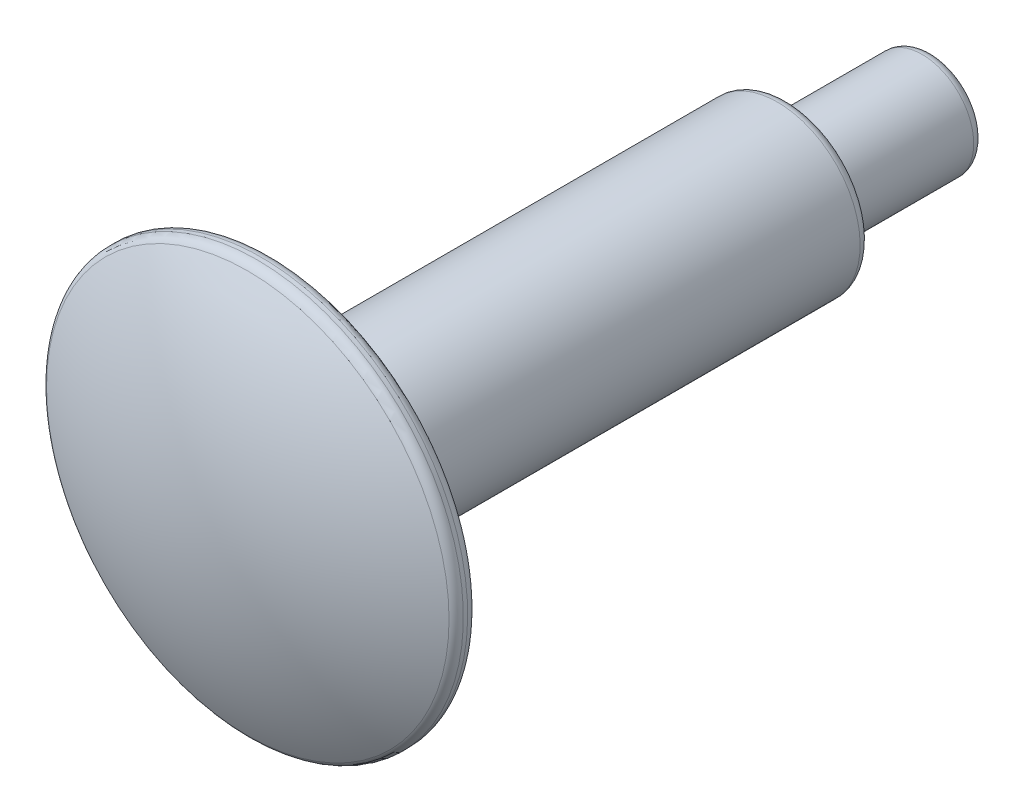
SolidWorks part; units mm, degrees
ref_plane "Спереди" through (0, 0, 0) normal (0, 0, 1) x (1, 0, 0)
ref_plane "Сверху" through (0, 0, 0) normal (0, 1, 0) x (1, 0, 0)
ref_plane "Справа" through (0, 0, 0) normal (1, 0, 0) x (0, 0, -1)
sketch "Эскиз1" plane through (0, 0, 0) normal (1, 0, 0) x (0, 0, -1)
  line L0 (-17.8397, 0) -> (17.8397, 0)
  line L1 (17.8397, 0) -> (17.8397, 2.5)
  line L2 (17.8397, 2.5) -> (10.8397, 2.5)
  line L3 (10.8397, 2.5) -> (10.8397, 4)
  line L4 (10.8397, 4) -> (-14.1603, 4)
  line L5 (-14.1603, 4) -> (-14.1603, 10)
  line L6 (-14.1603, 10) -> (-15.1603, 10)
  arc A0 (-15.1603, 10) -> (-17.8397, 0) centre (2.1603, 0) ccw
  dimension "D7" = 40
  dimension "D1" = 25
  dimension "D2" = 7
  dimension "D3" = 2.5
  dimension "D4" = 4
  dimension "D5" = 10
  dimension "D6" = 1
revolve "Повернуть1" add sketch "Эскиз1" angle 360 about L0
fillet "Скругление1" radius 0.5 6 edges at (0, -2.5, -17.8397) (0, -2.5, -10.8397) (0, -4, -10.8397) (0, -4, 14.1603) (0, -10, 15.1603) (0, -10, 14.1603)
